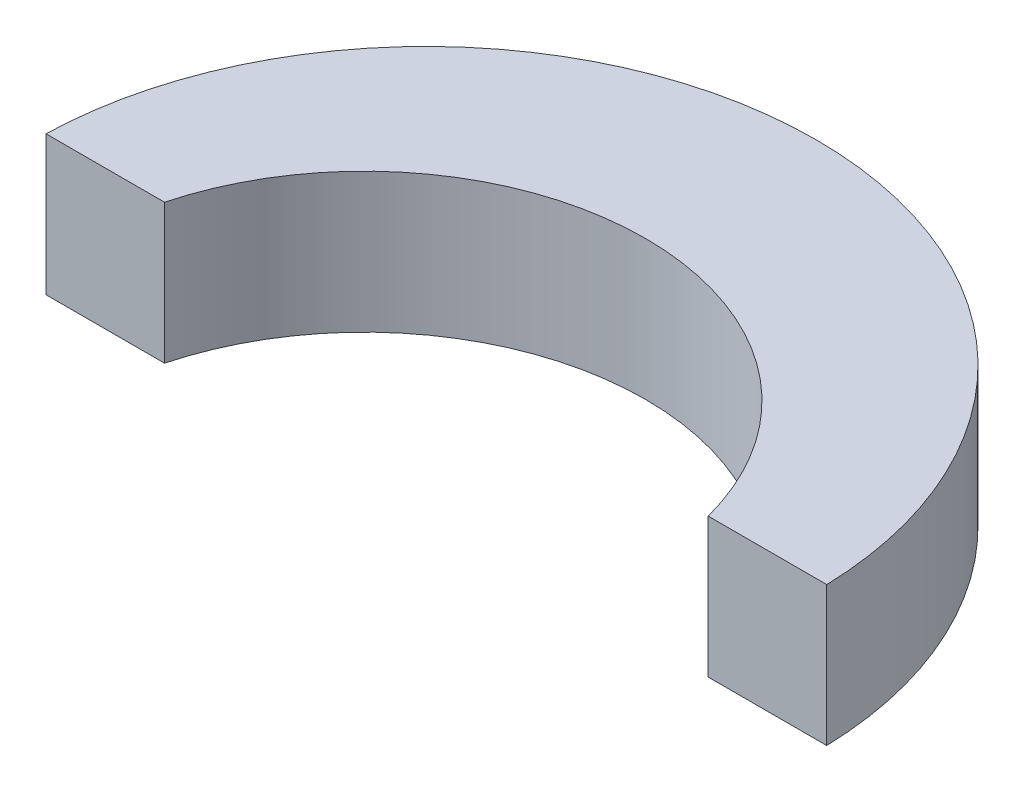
SolidWorks part; units mm, degrees
ref_plane "Ebene vorne" through (0, 0, 0) normal (0, 0, 1) x (1, 0, 0)
ref_plane "Ebene oben" through (0, 0, 0) normal (0, 1, 0) x (1, 0, 0)
ref_plane "Ebene rechts" through (0, 0, 0) normal (1, 0, 0) x (0, 0, -1)
sketch "Skizze1" plane through (0, 0, 0) normal (0, 1, 0) x (1, 0, 0)
  line L0 (-56, 0) -> (-39, 0)
  line L1 (39, 0) -> (56, 0)
  arc A0 (0, 30) -> (39, 0) centre (0, -10.35) cw
  arc A1 (0, 30) -> (-39, 0) centre (0, -10.35) ccw
  arc A2 (0, 54.5) -> (56, 0) centre (0, -1.5206) cw
  arc A3 (0, 54.5) -> (-56, 0) centre (0, -1.5206) ccw
  dimension "D1" = 39
  dimension "D2" = 17
  dimension "D3" = 39
  dimension "D4" = 17
  dimension "D5" = 30
  dimension "D6" = 54.5
extrude "Aufsatz-Linear austragen1" add sketch "Skizze1" along normal mid plane 20
sketch "Skizze3" plane through (0, 0, 0) normal (0, 1, 0) x (1, 0, 0)
  line L3 (39, 0) -> (40, 0)
  line L4 (-39, 0) -> (-40, 0)
  arc A0 (0, 30) -> (39, 0) centre (0, -10.35) cw
  arc A1 (0, 30) -> (-39, 0) centre (0, -10.35) ccw
  arc A2 (0, 38.15) -> (40, 0) centre (0, -1.8949) cw
  arc A3 (0, 38.15) -> (-40, 0) centre (0, -1.8949) ccw
  dimension "D2" = 8.15
  dimension "D4" = 1
  dimension "D5" = 1
sketch "Skizze4" plane through (0, 0, 0) normal (0, 0, 1) x (1, 0, 0)
  line L0 (-39, 0) -> (-39, 4.5)
  line L1 (0, 0) -> (-39, 0) construction
  line L3 (-39, 0) -> (-39, -4.5)
  line L4 (39, 0) -> (39, 4.5)
  line L5 (39, 0) -> (39, -4.5)
  line L6 (-40, 0) -> (-40, -4.5)
  line L7 (-40, 0) -> (-40, 4.5)
  line L8 (40, 0) -> (40, -4.5)
  line L9 (40, 0) -> (40, 4.5)
  line L10 (39, 4.5) -> (40, 4.5)
  line L11 (39, -4.5) -> (40, -4.5)
  line L12 (-40, 4.5) -> (-39, 4.5)
  line L13 (-40, -4.5) -> (-39, -4.5)
  dimension "D1" = 4.5
  dimension "D2" = 4.5
  dimension "D3" = 4.5
  dimension "D4" = 4.5
  dimension "D5" = 4.5
  dimension "D6" = 4.5
  dimension "D7" = 4.5
  dimension "D8" = 4.5
  dimension "D9" = 1
ref_plane "Ebene1" through (0, 0, -30) normal (0, 0, 1) x (1, 0, 0)
sketch "Skizze5" plane through (0, 0, -30) normal (0, 0, 1) x (1, 0, 0)
  line L0 (0, 0) -> (0, 6.5)
  line L1 (0, 0) -> (0, -6.5)
  dimension "D1" = 6.5
  dimension "D2" = 6.5
ref_plane "Ebene6" through (0, 0, -38.15) normal (0, 0, 1) x (1, 0, 0)
sketch "Skizze8" plane through (0, 0, -38.15) normal (0, 0, 1) x (1, 0, 0)
  line L0 (0, 0) -> (0, -4.5)
  line L1 (0, 0) -> (0, 4.5)
  dimension "D1" = 4.5
  dimension "D2" = 4.5
ref_plane "Ebene2" through (0, 4.4801, 0.2987) normal (0, 0.9978, 0.0665) x (-1, 0, 0)
sketch "Skizze6" plane through (0, 4.4801, 0.2987) normal (0, 0.9978, 0.0665) x (-1, 0, 0)
  arc A0 (0, -30.3659) -> (39, -0.2993) centre (0, 9.9612) ccw
  arc A1 (0, -30.3659) -> (-39, -0.2993) centre (0, 9.9612) cw
ref_plane "Ebene7" through (0, 4.5, 0) normal (0, 1, 0) x (-1, 0, 0)
sketch "Skizze10" plane through (0, 4.5, 0) normal (0, 1, 0) x (-1, 0, 0)
  arc A0 (0, -38.15) -> (-40, 0) centre (0, 1.8949) cw
  arc A1 (0, -38.15) -> (40, 0) centre (0, 1.8949) ccw
ref_plane "Ebene8" through (0, 0, 0) normal (-1, 0, 0) x (0, 0, 1)
sketch "Skizze11" plane through (0, 0, 0) normal (-1, 0, 0) x (0, 0, 1)
  line L0 (-30, 6.5) -> (-38.15, 4.5)
ref_plane "Ebene3" through (0, -4.4801, 0.2987) normal (0, -0.9978, 0.0665) x (1, 0, 0)
sketch "Skizze7" plane through (0, -4.4801, 0.2987) normal (0, -0.9978, 0.0665) x (1, 0, 0)
  arc A0 (0, -30.3659) -> (-39, -0.2993) centre (0, 9.9612) cw
  arc A1 (0, -30.3659) -> (39, -0.2993) centre (0, 9.9612) ccw
ref_plane "Ebene9" through (0, -4.5, 0) normal (0, -1, 0) x (1, 0, 0)
sketch "Skizze13" plane through (0, -4.5, 0) normal (0, -1, 0) x (1, 0, 0)
  arc A0 (0, -38.15) -> (-40, 0) centre (0, 1.8949) cw
  arc A1 (0, -38.15) -> (40, 0) centre (0, 1.8949) ccw
ref_plane "Ebene10" through (0, 0, 0) normal (1, 0, 0) x (0, 0, -1)
sketch "Skizze14" plane through (0, 0, 0) normal (1, 0, 0) x (0, 0, -1)
  line L0 (30, -6.5) -> (38.15, -4.5)
